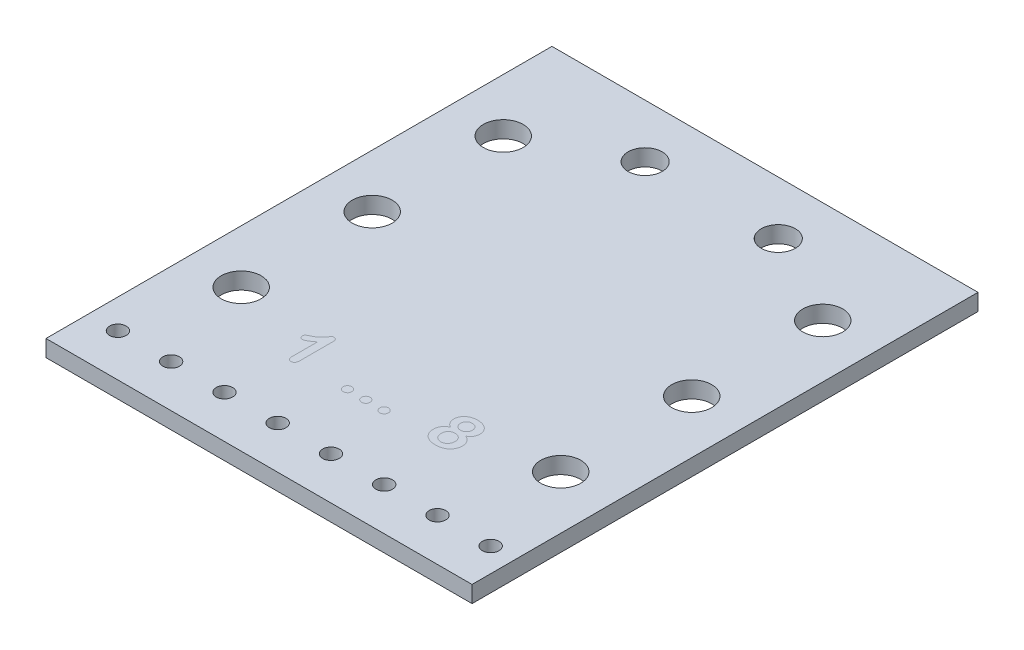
SolidWorks part; units mm, degrees
ref_plane "Front Plane" through (0, 0, 0) normal (0, 0, 1) x (1, 0, 0)
ref_plane "Top Plane" through (0, 0, 0) normal (0, 1, 0) x (1, 0, 0)
ref_plane "Right Plane" through (0, 0, 0) normal (1, 0, 0) x (0, 0, -1)
sketch "Sketch1" plane through (0, 0, 0) normal (0, 1, 0) x (1, 0, 0)
  line L0 (20.32, 48.26) -> (20.32, 0) construction
  line L1 (0, 0) -> (40.64, 0)
  line L2 (0, 0) -> (0, 48.26)
  line L3 (0, 48.26) -> (40.64, 48.26)
  line L4 (40.64, 0) -> (40.64, 48.26)
  circle A0 centre (5.08, 13.5382) radius 1.905
  circle A1 centre (5.08, 38.5343) radius 1.905
  circle A2 centre (35.56, 13.5382) radius 1.905
  circle A3 centre (35.56, 38.5343) radius 1.905
  circle A4 centre (5.08, 26.035) radius 1.905
  circle A5 centre (35.56, 26.035) radius 1.905
  dimension "D3" = 5.08
  dimension "D4" = 13.5382
  dimension "D5" = 38.5343
  dimension "D6" = 3.81
  dimension "D7" = 26.035
  dimension "D1" = 40.64
  dimension "D2" = 48.26
extrude "Boss-Extrude1" add sketch "Sketch1" against normal blind 1.5875
sketch "Sketch2" plane through (0, 0, 0) normal (0, 1, 0) x (1, 0, 0)
  line L0 (0, 48.26) -> (0, 0) construction
  line L1 (0, 0) -> (40.64, 0) construction
  line L2 (2.794, 4.064) -> (7.874, 4.064) construction
  circle A0 centre (2.794, 4.064) radius 0.7874
  circle A1 centre (7.874, 4.064) radius 0.7874
  circle A2 centre (12.954, 4.064) radius 0.7874
  circle A3 centre (18.034, 4.064) radius 0.7874
  circle A4 centre (23.114, 4.064) radius 0.7874
  circle A5 centre (28.194, 4.064) radius 0.7874
  circle A6 centre (33.274, 4.064) radius 0.7874
  circle A7 centre (38.354, 4.064) radius 0.7874
  dimension "D1" = 2.794
  dimension "D2" = 4.064
  dimension "D5" = 1.5748
  dimension "D4" = 5.08
  dimension "D3" = 8
extrude "screwHoles" cut sketch "Sketch2" against normal through all
ref_plane "Plane1" through (20.574, 0, 0) normal (-1, 0, 0) x (0, 0, 1)
sketch "Sketch3" plane through (0, 0, 0) normal (0, 1, 0) x (1, 0, 0)
  line L0 (0, 48.26) -> (0, 0) construction
  line L1 (0, 0) -> (40.64, 0) construction
  circle A0 centre (13.97, 43.18) radius 1.6256
  circle A1 centre (26.67, 43.18) radius 1.6256
  dimension "D1" = 13.97
  dimension "D3" = 43.18
  dimension "D4" = 3.2512
  dimension "D2" = 26.67
extrude "Cut-Extrude2" cut sketch "Sketch3" against normal through all
sketch "Sketch4" plane through (0, 0, 0) normal (0, 1, 0) x (1, 0, 0)
  line L0 (0, 9.8298) -> (40.64, 9.8298) construction
  line L1 (0, 48.26) -> (0, 0) construction
  line L2 (40.64, 0) -> (40.64, 48.26) construction
  line L3 (0, 0) -> (40.64, 0) construction
  text T0 "1  ...  8" font "Arial Rounded MT Bold" height in points 16
  dimension "D1" = 9.8298
